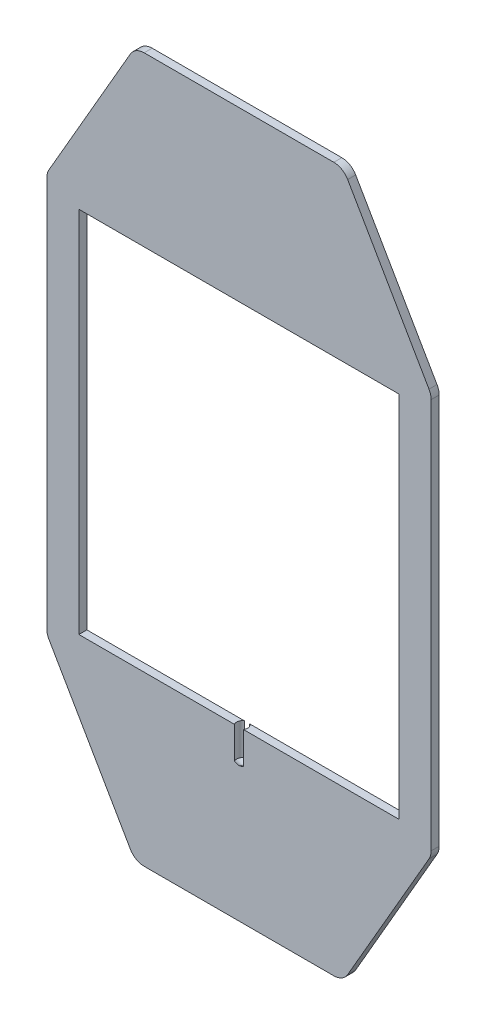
SolidWorks part; units mm, degrees
ref_plane "前视基准面" through (0, 0, 0) normal (0, 0, 1) x (1, 0, 0)
ref_plane "上视基准面" through (0, 0, 0) normal (0, 1, 0) x (1, 0, 0)
ref_plane "右视基准面" through (0, 0, 0) normal (1, 0, 0) x (0, 0, -1)
sketch "草图1" plane through (0, 0, 0) normal (0, 0, 1) x (1, 0, 0)
  line L0 (-98.6603, 121.6667) -> (-56.3212, 195)
  line L1 (47.661, 200) -> (-47.661, 200)
  line L2 (100, 116.6667) -> (100, -116.6667)
  line L3 (47.661, -200) -> (-47.661, -200)
  line L4 (-100, 116.6667) -> (-100, -116.6667)
  line L5 (-118.6603, 127.0257) -> (-67.8682, 215)
  line L6 (59.208, 220) -> (-59.208, 220)
  line L7 (0, 0) -> (0, 150) construction
  line L8 (0, 0) -> (100, 0) construction
  line L9 (98.6603, 121.6667) -> (56.3212, 195)
  line L10 (98.6603, -121.6667) -> (56.3212, -195)
  line L11 (-98.6603, -121.6667) -> (-56.3212, -195)
  line L12 (118.6603, 127.0257) -> (67.8682, 215)
  line L13 (120, 122.0257) -> (120, -122.0257)
  line L14 (118.6603, -127.0257) -> (67.8682, -215)
  line L15 (59.208, -220) -> (-59.208, -220)
  line L16 (-118.6603, -127.0257) -> (-67.8682, -215)
  line L17 (-120, 122.0257) -> (-120, -122.0257)
  line L18 (-120, -124.7051) -> (-64.9815, -220) construction
  line L19 (-120, 124.7051) -> (-120, -124.7051) construction
  line L20 (64.9815, -220) -> (-64.9815, -220) construction
  line L21 (120, -124.7051) -> (64.9815, -220) construction
  line L22 (120, 124.7051) -> (120, -124.7051) construction
  line L23 (-100, -119.3462) -> (-53.4345, -200) construction
  line L24 (53.4345, -200) -> (-53.4345, -200) construction
  line L25 (-100, 119.3462) -> (-100, -119.3462) construction
  line L26 (100, -119.3462) -> (53.4345, -200) construction
  line L27 (100, 119.3462) -> (100, -119.3462) construction
  line L28 (100, 119.3462) -> (53.4345, 200) construction
  line L29 (53.4345, 200) -> (-53.4345, 200) construction
  line L30 (-100, 119.3462) -> (-53.4345, 200) construction
  line L31 (120, 124.7051) -> (64.9815, 220) construction
  line L32 (64.9815, 220) -> (-64.9815, 220) construction
  line L33 (-120, 124.7051) -> (-64.9815, 220) construction
  arc A0 (-118.6603, -127.0257) -> (-120, -122.0257) centre (-110, -122.0257) cw
  arc A1 (-59.208, -220) -> (-67.8682, -215) centre (-59.208, -210) cw
  arc A2 (67.8682, -215) -> (59.208, -220) centre (59.208, -210) cw
  arc A3 (120, -122.0257) -> (118.6603, -127.0257) centre (110, -122.0257) cw
  arc A4 (-56.3212, -195) -> (-47.661, -200) centre (-47.661, -190) ccw
  arc A5 (-98.6603, -121.6667) -> (-100, -116.6667) centre (-90, -116.6667) cw
  arc A6 (56.3212, -195) -> (47.661, -200) centre (47.661, -190) cw
  arc A7 (98.6603, -121.6667) -> (100, -116.6667) centre (90, -116.6667) ccw
  arc A8 (56.3212, 195) -> (47.661, 200) centre (47.661, 190) ccw
  arc A9 (98.6603, 121.6667) -> (100, 116.6667) centre (90, 116.6667) cw
  arc A10 (-56.3212, 195) -> (-47.661, 200) centre (-47.661, 190) cw
  arc A11 (-98.6603, 121.6667) -> (-100, 116.6667) centre (-90, 116.6667) ccw
  arc A12 (118.6603, 127.0257) -> (120, 122.0257) centre (110, 122.0257) cw
  arc A13 (59.208, 220) -> (67.8682, 215) centre (59.208, 210) cw
  arc A14 (-67.8682, 215) -> (-59.208, 220) centre (-59.208, 210) cw
  arc A15 (-118.6603, 127.0257) -> (-120, 122.0257) centre (-110, 122.0257) ccw
  point P0 (0, 0)
  point P37 (-53.4345, -200)
  point P50 (53.4345, 200)
  dimension "D6" = 10
  dimension "D7" = 73.3333
  dimension "D1" = 400
  dimension "D2" = 200
  dimension "D3" = 100
  dimension "D4" = 200
  dimension "D5" = 20
  dimension "D8" = 30
  dimension "D9" = 73.3333
  dimension "D10" = 30
extrude "凸台-拉伸1" add sketch "草图1" along normal blind 30
sketch "草图2" plane through (0, 0, 30) normal (0, 0, 1) x (1, 0, 0)
  line L0 (-100, 130) -> (-70, 130)
  line L1 (-100, 116.6667) -> (-100, -116.6667) construction
  line L2 (-70, 130) -> (-70, 200)
  line L3 (47.661, 200) -> (-47.661, 200) construction
  line L4 (-70, 200) -> (-37.5, 200)
  line L5 (-37.5, 200) -> (-37.5, 115)
  line L6 (-37.5, 115) -> (-100, 115)
  line L7 (-100, 115) -> (-100, 130)
  line L8 (0, 0) -> (0, 200) construction
  dimension "D1" = 15
  dimension "D2" = 32.5
  dimension "D3" = 37.5
  dimension "D4" = 115
extrude "凸台-拉伸2" add sketch "草图2" against normal blind 40
mirror "镜向1" about plane through (0, 0, 0) normal (0, 1, 0) of "凸台-拉伸2"
mirror "镜向2" about plane through (0, 0, 0) normal (1, 0, 0) of "凸台-拉伸2", "镜向1"
sketch "草图3" plane through (0, 0, 0) normal (0, 0, -1) x (-1, 0, 0)
  line L0 (-100, 115) -> (100, 115)
  line L1 (100, 115) -> (100, -115)
  line L2 (100, -115) -> (-100, -115)
  line L3 (-100, -115) -> (-100, 115)
  line L8 (120, -122.0257) -> (120, 122.0257)
  line L10 (120, -122.0257) -> (120, 122.0257)
  line L12 (-120, 122.0257) -> (-120, -122.0257)
  line L13 (-118.6603, -127.0257) -> (-67.8682, -215)
  line L14 (118.6603, 127.0257) -> (67.8682, 215)
  line L20 (-120, 122.0257) -> (-120, -122.0257)
  line L21 (-118.6603, -127.0257) -> (-67.8682, -215)
  line L28 (118.6603, 127.0257) -> (67.8682, 215)
  line L29 (59.208, 220) -> (-59.208, 220)
  line L30 (59.208, 220) -> (-59.208, 220)
  line L31 (-67.8682, 215) -> (-118.6603, 127.0257)
  line L32 (-67.8682, 215) -> (-118.6603, 127.0257)
  line L34 (-59.208, -220) -> (59.208, -220)
  line L36 (-59.208, -220) -> (59.208, -220)
  line L38 (67.8682, -215) -> (118.6603, -127.0257)
  line L40 (67.8682, -215) -> (118.6603, -127.0257)
  arc A8 (118.6603, -127.0257) -> (120, -122.0257) centre (110, -122.0257) ccw
  arc A9 (118.6603, -127.0257) -> (120, -122.0257) centre (110, -122.0257) ccw
  arc A10 (120, 122.0257) -> (118.6603, 127.0257) centre (110, 122.0257) ccw
  arc A11 (120, 122.0257) -> (118.6603, 127.0257) centre (110, 122.0257) ccw
  arc A12 (-118.6603, 127.0257) -> (-120, 122.0257) centre (-110, 122.0257) ccw
  arc A13 (-120, -122.0257) -> (-118.6603, -127.0257) centre (-110, -122.0257) ccw
  arc A14 (67.8682, 215) -> (59.208, 220) centre (59.208, 210) ccw
  arc A15 (67.8682, 215) -> (59.208, 220) centre (59.208, 210) ccw
  arc A20 (-118.6603, 127.0257) -> (-120, 122.0257) centre (-110, 122.0257) ccw
  arc A21 (-120, -122.0257) -> (-118.6603, -127.0257) centre (-110, -122.0257) ccw
  arc A24 (-59.208, 220) -> (-67.8682, 215) centre (-59.208, 210) ccw
  arc A25 (-59.208, 220) -> (-67.8682, 215) centre (-59.208, 210) ccw
  arc A26 (-67.8682, -215) -> (-59.208, -220) centre (-59.208, -210) ccw
  arc A27 (-67.8682, -215) -> (-59.208, -220) centre (-59.208, -210) ccw
  arc A28 (59.208, -220) -> (67.8682, -215) centre (59.208, -210) ccw
  arc A29 (59.208, -220) -> (67.8682, -215) centre (59.208, -210) ccw
  dimension "D1" = 0
extrude "凸台-拉伸3" add sketch "草图3" along normal blind 20
sketch "草图5" plane through (0, 0, -20) normal (0, 0, -1) x (-1, 0, 0)
  line L0 (-67.8682, 215) -> (-67.8682, 310)
  line L1 (-67.8682, 310) -> (67.8682, 310)
  line L2 (67.8682, 310) -> (67.8682, 215)
  line L3 (59.208, 220) -> (-59.208, 220) construction
  line L4 (59.208, 220) -> (-59.208, 220)
  arc A0 (67.8682, 215) -> (59.208, 220) centre (59.208, 210) ccw construction
  arc A1 (-59.208, 220) -> (-67.8682, 215) centre (-59.208, 210) ccw construction
  arc A2 (67.8682, 215) -> (59.208, 220) centre (59.208, 210) ccw
  arc A3 (-59.208, 220) -> (-67.8682, 215) centre (-59.208, 210) ccw
  dimension "D1" = 90
extrude "凸台-拉伸11" add sketch "草图5" against normal blind 15 from offset 10
fillet "圆角3" radius 5 2 edges at (67.8682, 310, -2.5) (-67.8682, 310, -2.5)
sketch "草图6" plane through (0, 0, 0) normal (1, 0, 0) x (0, 0, -1)
  line L0 (-30, 220) -> (-5, 220) construction
  line L1 (17, 221) -> (-5, 221)
  line L2 (17, 221) -> (17, 199)
  line L3 (17, 199) -> (-5, 199)
  line L4 (-5, 221) -> (-5, 199)
  line L5 (17, 221) -> (-5, 199) construction
  line L6 (17, 199) -> (-5, 221) construction
  line L7 (-30, 127.0257) -> (-30, 215) construction
  point P0 (6, 210)
  dimension "D1" = 22
  dimension "D2" = 10
  dimension "D3" = 22
  dimension "D4" = 25
extrude "凸台-拉伸12" add sketch "草图6" along normal mid plane 450
sketch "草图10" plane through (0, 0, 30) normal (0, 0, 1) x (1, 0, 0)
  line L0 (-65, 122.5) -> (-65, 170) construction
  line L2 (-100, 115) -> (-37.5, 115) construction
  dimension "D1" = 65
  dimension "D2" = 7.5
  dimension "D3" = 47.5
hole_wizard "M8x1.0 螺纹孔1" positions "3D草图1" profile "草图11" tap size "M8x1.0" standard "GB"
sketch3d "3D草图1"
  point P0 (-65, 122.5, 30)
  point P3 (-65, 170, 30)
sketch "草图11" plane through (-65, 122.5, 30) normal (1, 0, 0) x (0, -1, 0)
  line L0 (0, 0) -> (0, 23.103)
  line L1 (0, 23.103) -> (3.5, 21)
  line L2 (3.5, 21) -> (3.5, 0)
  line L5 (3.5, 0) -> (0, 0)
  line L10 (0, 23.103) -> (-3.5, 21) construction
  line L11 (0, -6.35) -> (0, 107.95) construction
  dimension "螺纹孔钻头直径" = 7
  dimension "螺纹孔钻头深度" = 21
  dimension "导头角度" = 118
mirror "镜向7" about plane through (0, 0, 0) normal (1, 0, 0) of "M8x1.0 螺纹孔1"
sketch "草图14" plane through (0, 0, 0) normal (0, 0, 1) x (1, 0, 0)
  line L0 (-37.5, 200) -> (37.5, 200)
  line L1 (37.5, 200) -> (37.5, 199)
  line L2 (37.5, 199) -> (-37.5, 199)
  line L3 (-37.5, 199) -> (-37.5, 200)
extrude "切除-拉伸1" cut sketch "草图14" along normal blind 10
mirror "镜向8" about plane through (0, 0, 0) normal (0, 1, 0) of "切除-拉伸1", "凸台-拉伸12", "凸台-拉伸11"
sketch "草图15" plane through (0, 0, 5) normal (0, 0, 1) x (1, 0, 0)
  line L0 (225, 210) -> (191, 210) construction
  line L1 (194, 213) -> (188, 213)
  line L2 (194, 213) -> (194, 207)
  line L3 (194, 207) -> (188, 207)
  line L4 (188, 213) -> (188, 207)
  line L5 (194, 213) -> (188, 207) construction
  line L6 (194, 207) -> (188, 213) construction
  line L7 (225, 221) -> (225, 199) construction
  line L8 (191, 210) -> (176, 210) construction
  line L10 (179, 213) -> (173, 213)
  line L11 (179, 213) -> (179, 207)
  line L12 (179, 207) -> (173, 207)
  line L13 (173, 213) -> (173, 207)
  line L14 (179, 213) -> (173, 207) construction
  line L15 (179, 207) -> (173, 213) construction
  point P0 (191, 210)
  dimension "D1" = 6
  dimension "D2" = 6
  dimension "D3" = 34
  dimension "D4" = 15
  dimension "D5" = 6
  dimension "D6" = 6
sketch "草图16" plane through (0, 0, 5) normal (0, 0, 1) x (1, 0, 0)
  line L0 (135, 199) -> (135, -199)
  line L1 (225, 199) -> (77.1058, 199) construction
  line L2 (225, -199) -> (77.1058, -199) construction
  line L3 (135, -199) -> (77.1058, -199)
  line L4 (77.1058, -199) -> (118.6603, -127.0257)
  line L5 (120, -122.0257) -> (120, 122.0257) construction
  line L6 (120, -122.0257) -> (120, 122.0257)
  line L7 (118.6603, 127.0257) -> (67.8682, 215) construction
  line L8 (118.6603, 127.0257) -> (77.1058, 199)
  line L9 (135, 199) -> (77.1058, 199)
  line L10 (0, 0) -> (0, -200) construction
  line L11 (-37.5, -200) -> (37.5, -200) construction
  line L12 (-135, 199) -> (-77.1058, 199)
  line L13 (-118.6603, 127.0257) -> (-77.1058, 199)
  line L14 (-120, -122.0257) -> (-120, 122.0257)
  line L15 (-77.1058, -199) -> (-118.6603, -127.0257)
  line L16 (-135, -199) -> (-77.1058, -199)
  line L17 (-135, 199) -> (-135, -199)
  arc A0 (118.6603, -127.0257) -> (120, -122.0257) centre (110, -122.0257) ccw construction
  arc A1 (118.6603, -127.0257) -> (120, -122.0257) centre (110, -122.0257) ccw
  arc A2 (120, 122.0257) -> (118.6603, 127.0257) centre (110, 122.0257) ccw construction
  arc A3 (120, 122.0257) -> (118.6603, 127.0257) centre (110, 122.0257) ccw
  arc A4 (-120, 122.0257) -> (-118.6603, 127.0257) centre (-110, 122.0257) cw
  arc A5 (-118.6603, -127.0257) -> (-120, -122.0257) centre (-110, -122.0257) cw
  dimension "D1" = 15
extrude "凸台-拉伸13" add sketch "草图16" against normal blind 20 from offset 1
sketch "草图17" plane through (0, 0, 4) normal (0, 0, 1) x (1, 0, 0)
  line L0 (105.9734, 199) -> (135, 148.7244)
  line L1 (135, 199) -> (77.1058, 199) construction
  line L2 (135, -199) -> (135, 199) construction
  line L3 (135, 148.7244) -> (135, 199)
  line L4 (225, 199) -> (77.1058, 199) construction
  line L5 (135, 199) -> (105.9734, 199)
  line L6 (77.1058, 199) -> (118.6603, 127.0257) construction
  line L7 (118.6603, 127.0257) -> (67.8682, 215) construction
  line L8 (0, 0) -> (308.3014, 0) construction
  line L9 (135, -199) -> (105.9734, -199)
  line L10 (135, -148.7244) -> (135, -199)
  line L11 (105.9734, -199) -> (135, -148.7244)
  line L12 (0, 0) -> (0, -200) construction
  line L13 (-37.5, -200) -> (37.5, -200) construction
  line L14 (-105.9734, -199) -> (-135, -148.7244)
  line L15 (-135, -148.7244) -> (-135, -199)
  line L16 (-135, -199) -> (-105.9734, -199)
  line L17 (-135, 199) -> (-105.9734, 199)
  line L18 (-135, 148.7244) -> (-135, 199)
  line L19 (-105.9734, 199) -> (-135, 148.7244)
  dimension "D1" = 25
extrude "切除-拉伸3" cut sketch "草图17" against normal blind 20
fillet "圆角4" radius 5 8 edges at (105.9734, -199, -6) (135, -148.7244, -6) (135, 148.7244, -6) (105.9734, 199, -6) (-105.9734, 199, -6) (-135, 148.7244, -6) (-135, -148.7244, -6) (-105.9734, -199, -6)
sketch "草图18" plane through (225, 0, 0) normal (1, 0, 0) x (0, 0, -1)
  line L0 (-5, 199) -> (17, 199) construction
  line L1 (8, 203) -> (4, 203)
  line L2 (8, 203) -> (8, 195)
  line L3 (8, 195) -> (4, 195)
  line L4 (4, 203) -> (4, 195)
  line L5 (8, 203) -> (4, 195) construction
  line L6 (8, 195) -> (4, 203) construction
  point P0 (6, 199)
  dimension "D1" = 8
  dimension "D2" = 4
sketch "草图19" plane through (0, 0, 30) normal (0, 0, 1) x (1, 0, 0)
  line L3 (-93.849, 130) -> (-70, 130)
  line L4 (-70, 130) -> (-70, 171.3077)
  line L5 (-70, 171.3077) -> (-93.849, 130)
  line L6 (-93.849, 130) -> (-70, 130)
  line L7 (-70, 130) -> (-70, 171.3077)
  line L8 (-70, 171.3077) -> (-93.849, 130)
  line L9 (93.849, 130) -> (70, 171.3077)
  line L10 (70, 171.3077) -> (70, 130)
  line L11 (70, 130) -> (93.849, 130)
  line L12 (93.849, 130) -> (70, 171.3077)
  line L13 (70, 171.3077) -> (70, 130)
  line L14 (70, 130) -> (93.849, 130)
  line L15 (93.849, -130) -> (70, -130)
  line L16 (70, -130) -> (70, -171.3077)
  line L17 (70, -171.3077) -> (93.849, -130)
  line L18 (93.849, -130) -> (70, -130)
  line L19 (70, -130) -> (70, -171.3077)
  line L20 (70, -171.3077) -> (93.849, -130)
  line L21 (-93.849, -130) -> (-70, -171.3077)
  line L22 (-70, -171.3077) -> (-70, -130)
  line L23 (-70, -130) -> (-93.849, -130)
  line L24 (-93.849, -130) -> (-70, -171.3077)
  line L25 (-70, -171.3077) -> (-70, -130)
  line L26 (-70, -130) -> (-93.849, -130)
  dimension "D1" = 0
  dimension "D2" = 0
  dimension "D3" = 0
  dimension "D4" = 0
extrude "凸台-拉伸14" add sketch "草图19" against normal up to next
sketch "草图20" plane through (0, 0, -20) normal (0, 0, -1) x (-1, 0, 0)
  line L1 (-100, 115) -> (100, 115)
  line L2 (-100, 115) -> (-100, -115)
  line L3 (-100, -115) -> (100, -115)
  line L4 (100, 115) -> (100, -115)
  line L8 (120, -122.0257) -> (120, 122.0257)
  line L9 (118.6603, 127.0257) -> (67.8682, 215)
  line L10 (59.208, 220) -> (-59.208, 220)
  line L11 (-67.8682, 215) -> (-118.6603, 127.0257)
  line L12 (-120, 122.0257) -> (-120, -122.0257)
  line L13 (-118.6603, -127.0257) -> (-67.8682, -215)
  line L14 (-59.208, -220) -> (59.208, -220)
  line L15 (67.8682, -215) -> (118.6603, -127.0257)
  line L16 (120, -122.0257) -> (120, 122.0257)
  line L17 (118.6603, 127.0257) -> (67.8682, 215)
  line L18 (59.208, 220) -> (-59.208, 220)
  line L19 (-67.8682, 215) -> (-118.6603, 127.0257)
  line L20 (-120, 122.0257) -> (-120, -122.0257)
  line L21 (-118.6603, -127.0257) -> (-67.8682, -215)
  line L22 (-59.208, -220) -> (59.208, -220)
  line L23 (67.8682, -215) -> (118.6603, -127.0257)
  arc A8 (118.6603, -127.0257) -> (120, -122.0257) centre (110, -122.0257) ccw
  arc A9 (120, 122.0257) -> (118.6603, 127.0257) centre (110, 122.0257) ccw
  arc A10 (67.8682, 215) -> (59.208, 220) centre (59.208, 210) ccw
  arc A11 (-59.208, 220) -> (-67.8682, 215) centre (-59.208, 210) ccw
  arc A12 (-118.6603, 127.0257) -> (-120, 122.0257) centre (-110, 122.0257) ccw
  arc A13 (-120, -122.0257) -> (-118.6603, -127.0257) centre (-110, -122.0257) ccw
  arc A14 (-67.8682, -215) -> (-59.208, -220) centre (-59.208, -210) ccw
  arc A15 (59.208, -220) -> (67.8682, -215) centre (59.208, -210) ccw
  arc A16 (118.6603, -127.0257) -> (120, -122.0257) centre (110, -122.0257) ccw
  arc A17 (120, 122.0257) -> (118.6603, 127.0257) centre (110, 122.0257) ccw
  arc A18 (67.8682, 215) -> (59.208, 220) centre (59.208, 210) ccw
  arc A19 (-59.208, 220) -> (-67.8682, 215) centre (-59.208, 210) ccw
  arc A20 (-118.6603, 127.0257) -> (-120, 122.0257) centre (-110, 122.0257) ccw
  arc A21 (-120, -122.0257) -> (-118.6603, -127.0257) centre (-110, -122.0257) ccw
  arc A22 (-67.8682, -215) -> (-59.208, -220) centre (-59.208, -210) ccw
  arc A23 (59.208, -220) -> (67.8682, -215) centre (59.208, -210) ccw
  dimension "D1" = 0
extrude "凸台-拉伸15" add sketch "草图20" along normal blind 5
sketch "草图22" plane through (67.8682, 0, 0) normal (1, 0, 0) x (0, 0, -1)
  line L0 (10, 305) -> (10, 221) construction
  line L1 (10, 262) -> (0, 262)
  line L2 (10, 262) -> (10, 290)
  line L3 (10, 290) -> (0, 290)
  line L4 (0, 262) -> (0, 290)
  line L5 (-5, 310) -> (10, 310) construction
  line L6 (0, 264) -> (10, 266)
  line L7 (10, 272) -> (0, 274)
  line L8 (0, 276) -> (10, 276) construction
  line L9 (10, 280) -> (0, 278)
  line L10 (0, 288) -> (10, 286)
  dimension "D1" = 10
  dimension "D2" = 28
  dimension "D3" = 20
  dimension "D4" = 4
  dimension "D5" = 4
  dimension "D6" = 2
  dimension "D7" = 10
sketch "草图24" plane through (0, 0, 0) normal (0, 0, 1) x (1, 0, 0)
  line L4 (-37.5, -115) -> (-37.5, -200)
  line L7 (37.5, -115) -> (-37.5, -115)
  line L11 (37.5, -115) -> (-37.5, -115)
  line L16 (-37.5, -115) -> (-37.5, -200)
  line L19 (-37.5, -200) -> (37.5, -200)
  line L21 (-37.5, -200) -> (37.5, -200)
  line L22 (37.5, -200) -> (37.5, -115)
  line L23 (37.5, -200) -> (37.5, -115)
  dimension "D1" = 0
extrude "凸台-拉伸16" add sketch "草图24" along normal up to surface (30 mm away)
sketch "草图25" plane through (0, -115, 0) normal (0, 1, 0) x (1, 0, 0)
  line L0 (0, -30) -> (0, 22) construction
  line L1 (-100, -30) -> (100, -30) construction
  dimension "D1" = 52
hole_wizard "M8 螺纹孔1" positions "3D草图2" profile "草图26" tap size "M8" standard "GB"
sketch3d "3D草图2"
  point P0 (0, -115, -22)
sketch "草图26" plane through (0, -115, -22) normal (1, 0, 0) x (0, 0, 1)
  line L0 (0, 0) -> (0, 22.0429)
  line L1 (0, 22.0429) -> (3.4, 20)
  line L2 (3.4, 20) -> (3.4, 0)
  line L5 (3.4, 0) -> (0, 0)
  line L10 (0, 22.0429) -> (-3.4, 20) construction
  line L11 (0, -6.35) -> (0, 107.95) construction
  dimension "螺纹孔钻头直径" = 6.8
  dimension "螺纹孔钻头深度" = 20
  dimension "导头角度" = 118
sketch "草图27" plane through (0, 0, 30) normal (0, 0, 1) x (1, 0, 0)
  line L0 (-16, -115) -> (-16, -105)
  line L1 (-100, -115) -> (100, -115) construction
  line L2 (-16, -105) -> (16, -105)
  line L3 (0, -105) -> (0, -111) construction
  line L4 (12, -111) -> (-12, -111)
  line L5 (-12, -111) -> (-12, -115)
  line L6 (-12, -115) -> (-16, -115)
  line L7 (0, 0) -> (0, -105) construction
  line L8 (12, -115) -> (16, -115)
  line L9 (12, -111) -> (12, -115)
  line L10 (16, -115) -> (16, -105)
  dimension "D1" = 6
  dimension "D2" = 10
  dimension "D3" = 12
  dimension "D4" = 16
extrude "凸台-拉伸17" add sketch "草图27" against normal blind 5 from offset 12
pattern_linear "阵列(线性)2" count 2 spacing 26 along (0, 0, -1) of "凸台-拉伸17"
sketch "草图28" plane through (0, 0, 30) normal (0, 0, 1) x (1, 0, 0)
  line L0 (0, -115) -> (0, -152) construction
  line L1 (-100, -115) -> (100, -115) construction
  line L2 (0, -152) -> (-32, -152) construction
  line L3 (0, -152) -> (32, -152) construction
  dimension "D1" = 37
  dimension "D2" = 32
  dimension "D3" = 32
hole_wizard "M8 螺纹孔2" positions "3D草图3" profile "草图29" tap size "M8" standard "GB"
sketch3d "3D草图3"
  point P0 (-32, -152, 30)
  point P3 (32, -152, 30)
sketch "草图29" plane through (-32, -152, 30) normal (1, 0, 0) x (0, -1, 0)
  line L0 (0, 0) -> (0, 24.5429)
  line L1 (0, 24.5429) -> (3.4, 22.5)
  line L2 (3.4, 22.5) -> (3.4, 0)
  line L5 (3.4, 0) -> (0, 0)
  line L10 (0, 24.5429) -> (-3.4, 22.5) construction
  line L11 (0, -6.35) -> (0, 107.95) construction
  dimension "螺纹孔钻头直径" = 6.8
  dimension "螺纹孔钻头深度" = 22.5
  dimension "导头角度" = 118
sketch "草图30" plane through (-67.8682, 0, 0) normal (-1, 0, 0) x (0, 0, 1)
  line L0 (-10, -310) -> (-38.263, -300.579)
  line L1 (-57.2367, -297.5) -> (-125, -297.5)
  line L2 (-127.5, -295) -> (-127.5, -290)
  line L3 (-125, -287.5) -> (-10, -287.5)
  line L4 (-10, -221) -> (-10, -310) construction
  line L5 (-10, -287.5) -> (-10, -310)
  arc A0 (-38.263, -300.579) -> (-57.2367, -297.5) centre (-57.2367, -357.5) ccw
  arc A1 (-127.5, -290) -> (-125, -287.5) centre (-125, -290) cw
  arc A2 (-125, -297.5) -> (-127.5, -295) centre (-125, -295) cw
  point P10 (-47.5, -297.5)
  point P13 (-127.5, -287.5)
  point P16 (-127.5, -297.5)
  dimension "D5" = 60
  dimension "D6" = 2.5
  dimension "D1" = 12.5
  dimension "D2" = 10
  dimension "D3" = 117.5
  dimension "D4" = 80
sketch "草图32" plane through (0, 0, 30) normal (0, 0, 1) x (1, 0, 0)
  line L0 (-37.5, 200) -> (-52.5, 200)
  line L1 (-52.5, 200) -> (-52.5, 115)
  line L2 (-100, 115) -> (-37.5, 115) construction
  line L3 (-52.5, 115) -> (-37.5, 115)
  line L4 (-37.5, 115) -> (-37.5, 200)
  dimension "D1" = 15
extrude "切除-拉伸7" cut sketch "草图32" against normal up to surface (30 mm away)
sketch "草图33" plane through (0, 0, 0) normal (0, 0, 1) x (1, 0, 0)
  line L4 (37.5, 115) -> (37.5, 200)
  line L6 (-52.5, 200) -> (-52.5, 115)
  line L7 (-52.5, 115) -> (37.5, 115)
  line L10 (-52.5, 200) -> (-52.5, 115)
  line L11 (-52.5, 115) -> (37.5, 115)
  line L12 (37.5, 115) -> (37.5, 200)
  line L14 (37.5, 200) -> (-52.5, 200)
  line L15 (37.5, 200) -> (-52.5, 200)
  dimension "D1" = 0
extrude "切除-拉伸8" cut sketch "草图33" against normal blind 12
sketch "草图34" plane through (0, 0, 30) normal (0, 0, 1) x (1, 0, 0)
  line L0 (-100, -115) -> (100, -115) construction
  line L1 (-50, -115) -> (50, -115)
  line L2 (-50, -115) -> (-50, -174)
  line L3 (-50, -174) -> (50, -174)
  line L4 (50, -115) -> (50, -174)
  line L5 (0, -174) -> (0, -220) construction
  line L6 (59.208, -220) -> (-59.208, -220) construction
  dimension "D1" = 100
  dimension "D2" = 59
extrude "切除-拉伸9" cut sketch "草图34" against normal blind 9.25
sketch "草图35" plane through (0, 0, 30) normal (0, 0, 1) x (1, 0, 0)
  line L2 (-175.1264, 290.7759) -> (175.1264, 290.7759)
  line L3 (-175.1264, 290.7759) -> (-175.1264, -290.7759)
  line L4 (-175.1264, -290.7759) -> (175.1264, -290.7759)
  line L5 (175.1264, 290.7759) -> (175.1264, -290.7759)
  line L6 (-175.1264, 290.7759) -> (175.1264, -290.7759) construction
  line L7 (-175.1264, -290.7759) -> (175.1264, 290.7759) construction
  point P2 (0, 0)
extrude "切除-拉伸10" cut sketch "草图35" against normal offset from surface (21 mm away) 5
sketch "草图40" plane through (0, 0, -25) normal (0, 0, -1) x (-1, 0, 0)
  line L1 (-294.8809, 339.2041) -> (294.8809, 339.2041)
  line L2 (-294.8809, 339.2041) -> (-294.8809, -339.2041)
  line L3 (-294.8809, -339.2041) -> (294.8809, -339.2041)
  line L4 (294.8809, 339.2041) -> (294.8809, -339.2041)
  line L5 (-294.8809, 339.2041) -> (294.8809, -339.2041) construction
  line L6 (-294.8809, -339.2041) -> (294.8809, 339.2041) construction
  point P0 (0, 0)
sketch "草图42" plane through (0, 0, -25) normal (0, 0, -1) x (-1, 0, 0)
  line L8 (120, -122.0257) -> (120, 122.0257)
  line L9 (118.6603, 127.0257) -> (67.8682, 215)
  line L10 (59.208, 220) -> (-59.208, 220)
  line L11 (-67.8682, 215) -> (-118.6603, 127.0257)
  line L12 (-120, 122.0257) -> (-120, -122.0257)
  line L13 (-118.6603, -127.0257) -> (-67.8682, -215)
  line L14 (-59.208, -220) -> (59.208, -220)
  line L15 (67.8682, -215) -> (118.6603, -127.0257)
  line L16 (120, -122.0257) -> (120, 122.0257)
  line L17 (118.6603, 127.0257) -> (67.8682, 215)
  line L18 (59.208, 220) -> (-59.208, 220)
  line L19 (-67.8682, 215) -> (-118.6603, 127.0257)
  line L20 (-120, 122.0257) -> (-120, -122.0257)
  line L21 (-118.6603, -127.0257) -> (-67.8682, -215)
  line L22 (-59.208, -220) -> (59.208, -220)
  line L23 (67.8682, -215) -> (118.6603, -127.0257)
  arc A8 (118.6603, -127.0257) -> (120, -122.0257) centre (110, -122.0257) ccw
  arc A9 (120, 122.0257) -> (118.6603, 127.0257) centre (110, 122.0257) ccw
  arc A10 (67.8682, 215) -> (59.208, 220) centre (59.208, 210) ccw
  arc A11 (-59.208, 220) -> (-67.8682, 215) centre (-59.208, 210) ccw
  arc A12 (-118.6603, 127.0257) -> (-120, 122.0257) centre (-110, 122.0257) ccw
  arc A13 (-120, -122.0257) -> (-118.6603, -127.0257) centre (-110, -122.0257) ccw
  arc A14 (-67.8682, -215) -> (-59.208, -220) centre (-59.208, -210) ccw
  arc A15 (59.208, -220) -> (67.8682, -215) centre (59.208, -210) ccw
  arc A16 (118.6603, -127.0257) -> (120, -122.0257) centre (110, -122.0257) ccw
  arc A17 (120, 122.0257) -> (118.6603, 127.0257) centre (110, 122.0257) ccw
  arc A18 (67.8682, 215) -> (59.208, 220) centre (59.208, 210) ccw
  arc A19 (-59.208, 220) -> (-67.8682, 215) centre (-59.208, 210) ccw
  arc A20 (-118.6603, 127.0257) -> (-120, 122.0257) centre (-110, 122.0257) ccw
  arc A21 (-120, -122.0257) -> (-118.6603, -127.0257) centre (-110, -122.0257) ccw
  arc A22 (-67.8682, -215) -> (-59.208, -220) centre (-59.208, -210) ccw
  arc A23 (59.208, -220) -> (67.8682, -215) centre (59.208, -210) ccw
  dimension "D1" = 0
sketch "草图43" plane through (0, 0, -25) normal (0, 0, -1) x (-1, 0, 0)
  line L1 (-227.3114, 369.6277) -> (227.3114, 369.6277)
  line L2 (-227.3114, 369.6277) -> (-227.3114, -369.6277)
  line L3 (-227.3114, -369.6277) -> (227.3114, -369.6277)
  line L4 (227.3114, 369.6277) -> (227.3114, -369.6277)
  line L5 (-227.3114, 369.6277) -> (227.3114, -369.6277) construction
  line L6 (-227.3114, -369.6277) -> (227.3114, 369.6277) construction
  line L8 (120, -122.0257) -> (120, 122.0257)
  line L9 (118.6603, 127.0257) -> (67.8682, 215)
  line L10 (59.208, 220) -> (-59.208, 220)
  line L11 (-67.8682, 215) -> (-118.6603, 127.0257)
  line L12 (-120, 122.0257) -> (-120, -122.0257)
  line L13 (-118.6603, -127.0257) -> (-67.8682, -215)
  line L14 (-59.208, -220) -> (59.208, -220)
  line L15 (67.8682, -215) -> (118.6603, -127.0257)
  line L16 (120, -122.0257) -> (120, 122.0257)
  line L17 (118.6603, 127.0257) -> (67.8682, 215)
  line L18 (59.208, 220) -> (-59.208, 220)
  line L19 (-67.8682, 215) -> (-118.6603, 127.0257)
  line L20 (-120, 122.0257) -> (-120, -122.0257)
  line L21 (-118.6603, -127.0257) -> (-67.8682, -215)
  line L22 (-59.208, -220) -> (59.208, -220)
  line L23 (67.8682, -215) -> (118.6603, -127.0257)
  arc A8 (118.6603, -127.0257) -> (120, -122.0257) centre (110, -122.0257) ccw
  arc A9 (120, 122.0257) -> (118.6603, 127.0257) centre (110, 122.0257) ccw
  arc A10 (67.8682, 215) -> (59.208, 220) centre (59.208, 210) ccw
  arc A11 (-59.208, 220) -> (-67.8682, 215) centre (-59.208, 210) ccw
  arc A12 (-118.6603, 127.0257) -> (-120, 122.0257) centre (-110, 122.0257) ccw
  arc A13 (-120, -122.0257) -> (-118.6603, -127.0257) centre (-110, -122.0257) ccw
  arc A14 (-67.8682, -215) -> (-59.208, -220) centre (-59.208, -210) ccw
  arc A15 (59.208, -220) -> (67.8682, -215) centre (59.208, -210) ccw
  arc A16 (118.6603, -127.0257) -> (120, -122.0257) centre (110, -122.0257) ccw
  arc A17 (120, 122.0257) -> (118.6603, 127.0257) centre (110, 122.0257) ccw
  arc A18 (67.8682, 215) -> (59.208, 220) centre (59.208, 210) ccw
  arc A19 (-59.208, 220) -> (-67.8682, 215) centre (-59.208, 210) ccw
  arc A20 (-118.6603, 127.0257) -> (-120, 122.0257) centre (-110, 122.0257) ccw
  arc A21 (-120, -122.0257) -> (-118.6603, -127.0257) centre (-110, -122.0257) ccw
  arc A22 (-67.8682, -215) -> (-59.208, -220) centre (-59.208, -210) ccw
  arc A23 (59.208, -220) -> (67.8682, -215) centre (59.208, -210) ccw
  point P0 (0, 0)
  dimension "D1" = 0
extrude "切除-拉伸16" cut sketch "草图43" against normal blind 252 from offset 5
sketch "草图44" plane through (0, 0, -20) normal (0, 0, 1) x (1, 0, 0)
  line L1 (-165.5925, 247.304) -> (165.5925, 247.304)
  line L2 (-165.5925, 247.304) -> (-165.5925, -247.304)
  line L3 (-165.5925, -247.304) -> (165.5925, -247.304)
  line L4 (165.5925, 247.304) -> (165.5925, -247.304)
  line L5 (-165.5925, 247.304) -> (165.5925, -247.304) construction
  line L6 (-165.5925, -247.304) -> (165.5925, 247.304) construction
  point P0 (0, 0)
extrude "切除-拉伸18" cut sketch "草图44" along normal blind 542
